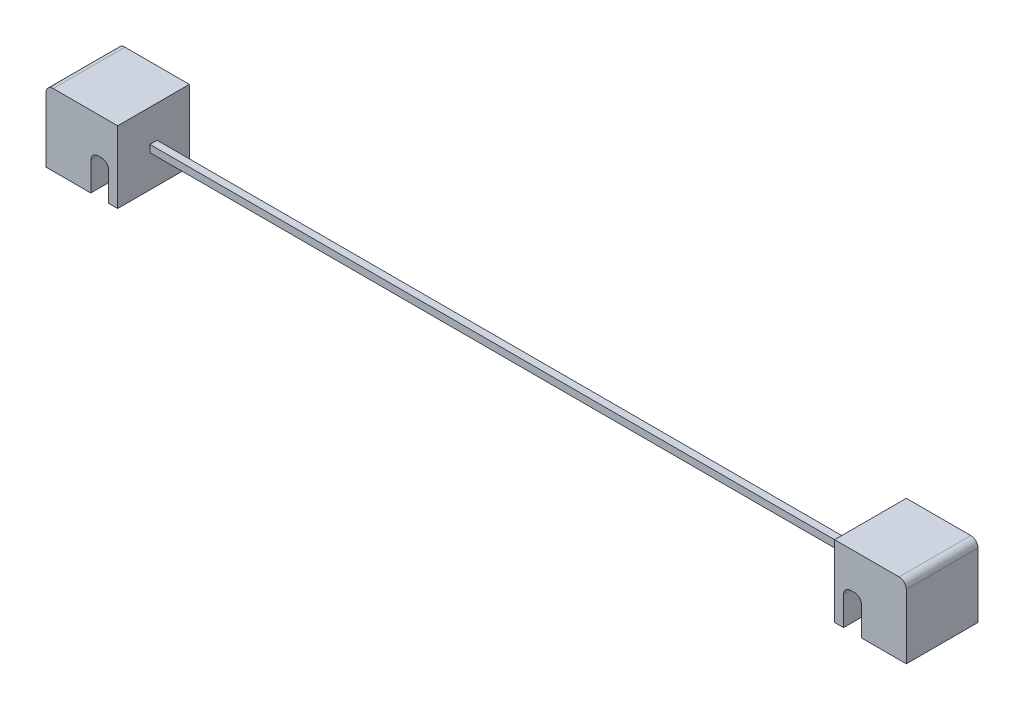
SolidWorks part; units mm, degrees
ref_plane "Front Plane" through (0, 0, 0) normal (0, 0, 1) x (1, 0, 0)
ref_plane "Top Plane" through (0, 0, 0) normal (0, 1, 0) x (1, 0, 0)
ref_plane "Right Plane" through (0, 0, 0) normal (1, 0, 0) x (0, 0, -1)
sketch "Sketch2" plane through (0, 0, 0) normal (0, 0, 1) x (1, 0, 0)
  line L0 (-35.7143, -71.4286) -> (-35.7143, 549.1458) construction
  line L1 (71.4286, -71.4286) -> (-71.4286, -71.4286)
  line L2 (71.4286, -71.4286) -> (71.4286, 57.1429)
  line L3 (57.1429, 71.4286) -> (-71.4286, 71.4286)
  line L4 (-71.4286, -71.4286) -> (-71.4286, 71.4286)
  line L5 (71.4286, -71.4286) -> (-71.4286, 71.4286) construction
  line L6 (71.4286, 71.4286) -> (-71.4286, -71.4286) construction
  line L8 (-53.5714, -71.4286) -> (-17.8571, -71.4286)
  line L9 (-53.5714, -71.4286) -> (-53.5714, -14.2857)
  line L10 (-39.2857, 0) -> (-32.1429, 0)
  line L11 (-17.8571, -71.4286) -> (-17.8571, -14.2857)
  arc A0 (71.4286, 57.1429) -> (57.1429, 71.4286) centre (57.1429, 57.1429) ccw
  arc A1 (-32.1429, 0) -> (-17.8571, -14.2857) centre (-32.1429, -14.2857) cw
  arc A2 (-53.5714, -14.2857) -> (-39.2857, 0) centre (-39.2857, -14.2857) cw
  point P0 (0, 0)
  point P17 (-17.8571, 0)
  point P20 (-53.5714, 0)
  dimension "D4" = 14.2857
  dimension "D8" = 14.2857
  dimension "D1" = 142.8571
  dimension "D2" = 142.8571
  dimension "D3" = 35.7143
  dimension "D5" = 71.4286
  dimension "D6" = 35.7143
  dimension "D7" = 17.8571
extrude "Boss-Extrude2" add sketch "Sketch2" along normal blind 142.8571 contours L9 A2 L10 A1 L11 L1 L2 A0 L3 L4
ref_plane "Plane1" through (-71.4286, 0, 0) normal (-1, 0, 0) x (0, 0, 1)
sketch "Sketch3" plane through (-71.4286, 0, 0) normal (-1, 0, 0) x (0, 0, 1)
  line L0 (71.4286, 261.7114) -> (71.4286, -262.8227) construction
  line L1 (142.8571, -71.4286) -> (142.8571, 71.4286) construction
  line L2 (0, 0) -> (142.8571, 0) construction
  line L4 (78.5714, -7.1429) -> (64.2857, -7.1429)
  line L5 (78.5714, -7.1429) -> (78.5714, 7.1429)
  line L6 (78.5714, 7.1429) -> (64.2857, 7.1429)
  line L7 (64.2857, -7.1429) -> (64.2857, 7.1429)
  line L8 (78.5714, -7.1429) -> (64.2857, 7.1429) construction
  line L9 (78.5714, 7.1429) -> (64.2857, -7.1429) construction
  point P7 (71.4286, 0)
  dimension "D3" = 14.2857
  dimension "D1" = 71.4286
  dimension "D2" = 14.2857
extrude "Boss-Extrude3" add sketch "Sketch3" along normal blind 1428.5714
ref_plane "Plane2" through (-785.7143, 0, 0) normal (-1, 0, 0) x (0, 0, 1)
mirror "Mirror1" about plane through (-785.7143, 0, 0) normal (-1, 0, 0) of "Boss-Extrude2"
